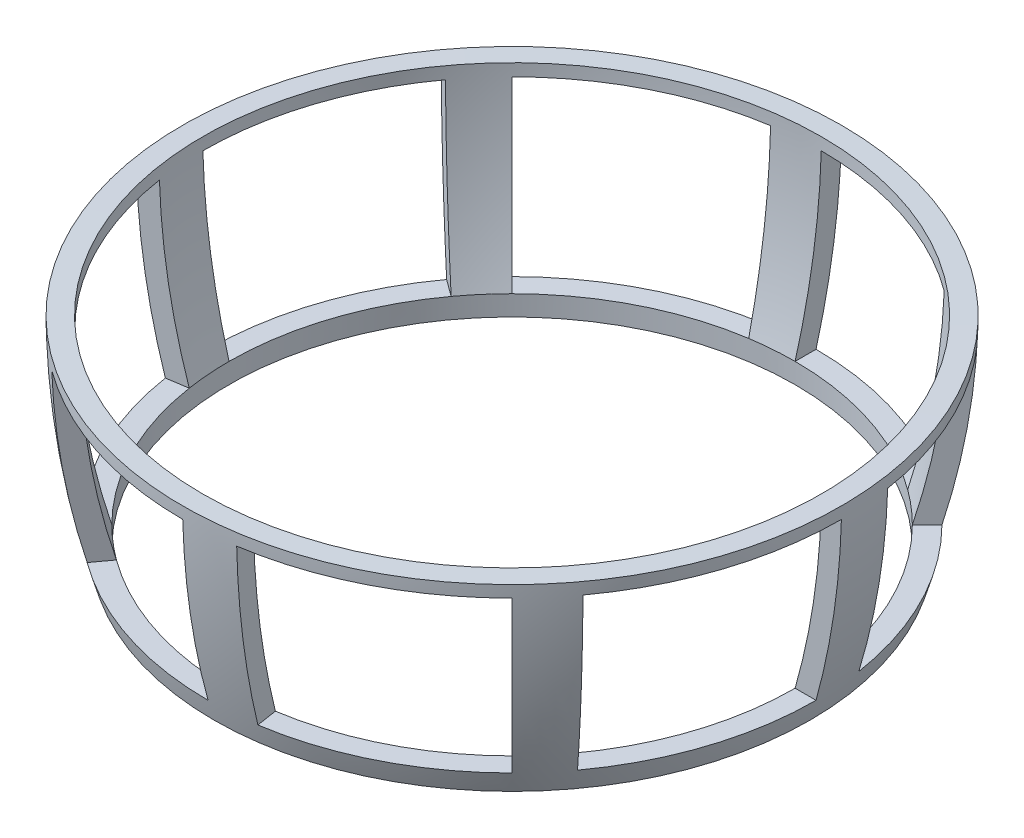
SolidWorks part; units mm, degrees
ref_plane "Front Plane" through (0, 0, 0) normal (0, 0, 1) x (1, 0, 0)
ref_plane "Top Plane" through (0, 0, 0) normal (0, 1, 0) x (1, 0, 0)
ref_plane "Right Plane" through (0, 0, 0) normal (1, 0, 0) x (0, 0, -1)
sketch "Sketch1" plane through (0, 0, 0) normal (0, 0, 1) x (1, 0, 0)
  line L0 (0, 0) -> (70.2, 0)
  line L1 (0, 0) -> (0, 43.5802) construction
  arc A0 (70.2, 0) -> (76.7409, 45) centre (-93.7872, 46.8116) ccw
  dimension "D1" = 70.2
  dimension "D2" = 45
revolve "Revolve-Thin2" add sketch "Sketch1" angle 45 about L1
sketch "Sketch2" plane through (0, 0, 0) normal (0, 1, 0) x (1, 0, 0)
  line L0 (0, 0) -> (80.7882, 12.4417)
  line L1 (81.7406, 0) -> (0, 0)
  arc A0 (81.7406, 0) -> (57.7994, 57.7994) centre (0, 0) ccw construction
  arc A1 (80.7882, 12.4417) -> (81.7406, 0) centre (11.5462, 0.8839) cw
extrude "Cut-Extrude2" cut sketch "Sketch2" along normal blind 42 flip side to cut
pattern_circular "CirPattern6" count 8 over 360 about axis through (0, 0, 0) along (0, 1, 0) of "Revolve-Thin2", "Cut-Extrude2"
sketch "Sketch10" plane through (0, 0, 0) normal (0, 1, 0) x (1, 0, 0)
  circle A0 centre (0, 0) radius 70.2
extrude "Cut-Extrude3" cut sketch "Sketch10" against normal through all
